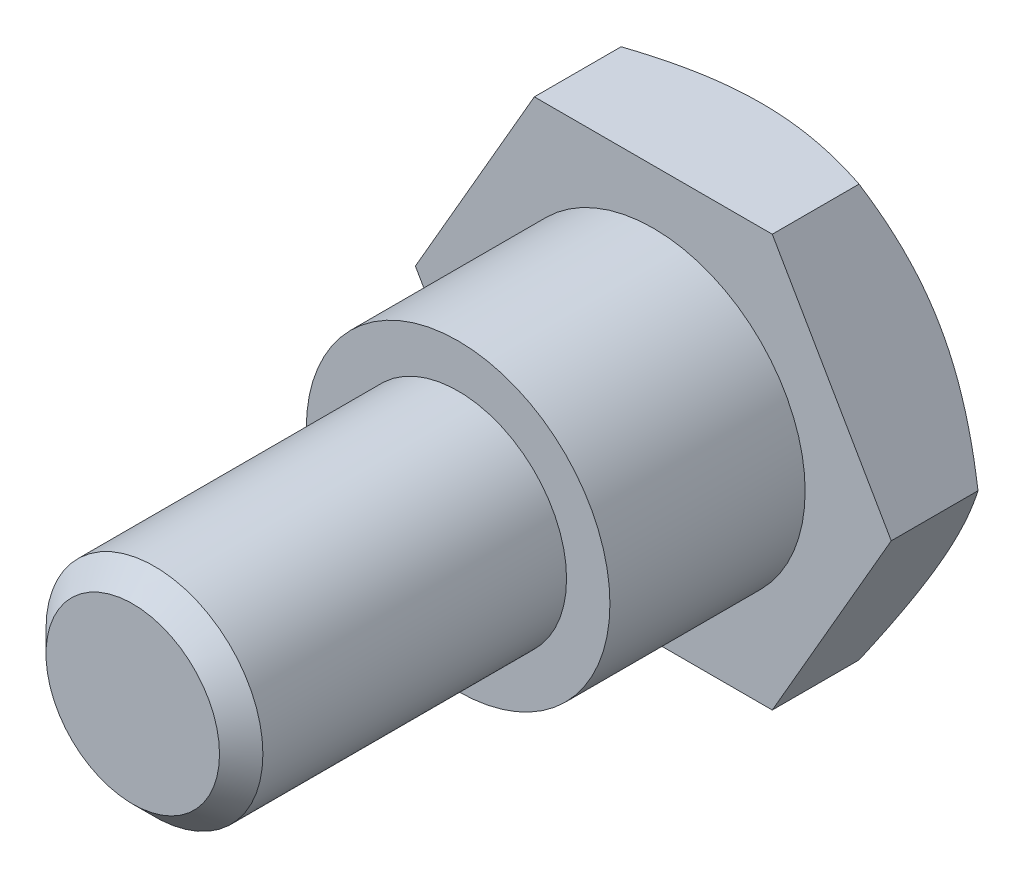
SolidWorks part; units mm, degrees
ref_plane "Přední" through (0, 0, 0) normal (0, 0, 1) x (1, 0, 0)
ref_plane "Horní" through (0, 0, 0) normal (0, 1, 0) x (1, 0, 0)
ref_plane "Pravá" through (0, 0, 0) normal (1, 0, 0) x (0, 0, -1)
sketch "Skica1" plane through (0, 0, 0) normal (0, 0, 1) x (1, 0, 0)
  line L1 (-5.4848, 9.5) -> (-10.9697, 0)
  line L2 (-10.9697, 0) -> (-5.4848, -9.5)
  line L3 (-5.4848, -9.5) -> (5.4848, -9.5)
  line L4 (5.4848, -9.5) -> (10.9697, 0)
  line L5 (10.9697, 0) -> (5.4848, 9.5)
  line L6 (5.4848, 9.5) -> (-5.4848, 9.5)
  circle A0 centre (0, 0) radius 9.5 construction
  dimension "D1" = 19
extrude "Vysunout1" add sketch "Skica1" along normal blind 29
sketch "Skica2" plane through (0, 0, 0) normal (0, 0, -1) x (-1, 0, 0)
  circle A0 centre (0, 0) radius 7
  dimension "D1" = 14
extrude "Odebrat vysunutím1" cut sketch "Skica2" against normal blind 32 from offset 5 flip side to cut
sketch "Skica3" plane through (0, 0, 29) normal (0, 0, 1) x (1, 0, 0)
  circle A0 centre (0, 0) radius 5
  dimension "D1" = 10
extrude "Odebrat vysunutím2" cut sketch "Skica3" against normal blind 15 flip side to cut
chamfer "Zkosit2" distance 1 angle 45 1 edges at (5, 0, 29)
sketch "Skica4" plane through (0, 0, 0) normal (0, 1, 0) x (1, 0, 0)
  line L0 (-9.4697, 0) -> (-10.9697, -1)
  line L2 (-10.9697, -5) -> (-10.9697, 0) construction
  line L3 (-10.9697, -1) -> (-10.9697, 0)
  line L4 (-10.9697, 0) -> (-9.4697, 0)
  dimension "D1" = 1
  dimension "D2" = 1.5
revolve "Odebrat otočením1" cut sketch "Skica4" angle 360 about axis through (0, 0, 37) along (0, 0, -1)
